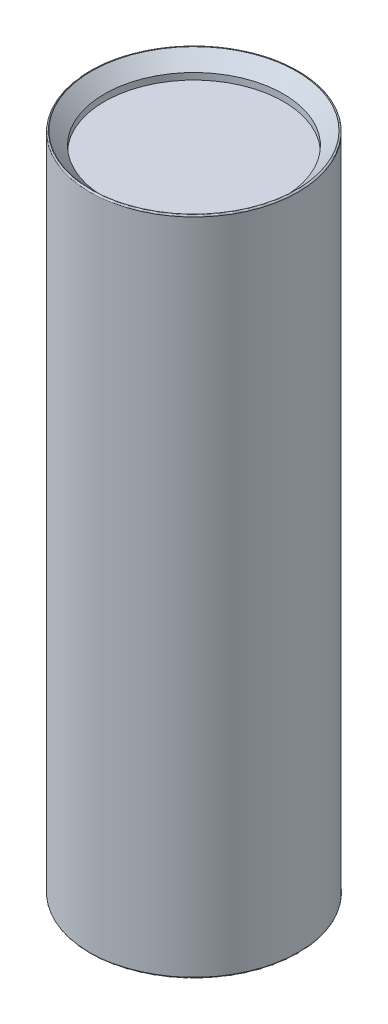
SolidWorks part; units mm, degrees
ref_plane "Front Plane" through (0, 0, 0) normal (0, 0, 1) x (1, 0, 0)
ref_plane "Top Plane" through (0, 0, 0) normal (0, 1, 0) x (1, 0, 0)
ref_plane "Right Plane" through (0, 0, 0) normal (1, 0, 0) x (0, 0, -1)
sketch "Sketch1" plane through (0, 0, 0) normal (0, 1, 0) x (1, 0, 0)
  circle A0 centre (0, 0) radius 20.193
  dimension "D1" = 40.386
extrude "Boss-Extrude1" add sketch "Sketch1" along normal blind 128.016
sketch "Sketch2" plane through (0, 128.016, 0) normal (0, 1, 0) x (1, 0, 0)
  circle A0 centre (0, 0) radius 17.3284
extrude "Cut-Extrude1" cut sketch "Sketch2" against normal blind 3.81
chamfer "Chamfer1" distance 2.54 angle 45 1 edges at (0, 128.016, 17.3284)
fillet "Fillet1" radius 0.254 2 edges at (0, 128.016, 20.193) (0, 0, 20.193)
hole_wizard "7/16-20 Tapped Hole1" positions "Sketch4" profile "Sketch3" tap size "7/16-20" standard "Ansi Inch"
sketch "Sketch4" plane through (0, 0, 0) normal (0, -1, 0) x (1, 0, 0)
  circle A0 centre (0, 0) radius 19.939 construction
  point P0 (0, 0)
sketch "Sketch3" plane through (0, 0, 0) normal (1, 0, 0) x (0, 0, -1)
  line L0 (0, 0) -> (0, 29.0156)
  line L1 (0, 29.0156) -> (4.9606, 26.035)
  line L2 (4.9606, 26.035) -> (4.9606, 22.225)
  line L3 (4.9606, 22.225) -> (5.5562, 22.225)
  line L4 (5.5562, 22.225) -> (5.5562, 0)
  line L5 (5.5562, 0) -> (0, 0)
  line L10 (0, 29.0156) -> (-4.9606, 26.035) construction
  line L11 (0, -6.35) -> (0, 107.95) construction
  dimension "Tap Drill Dia." = 9.9212
  dimension "Tap Drill Depth" = 26.035
  dimension "Thread Major Dia." = 11.1125
  dimension "Thread Depth" = 22.225
  dimension "Drill Angle" = 118
